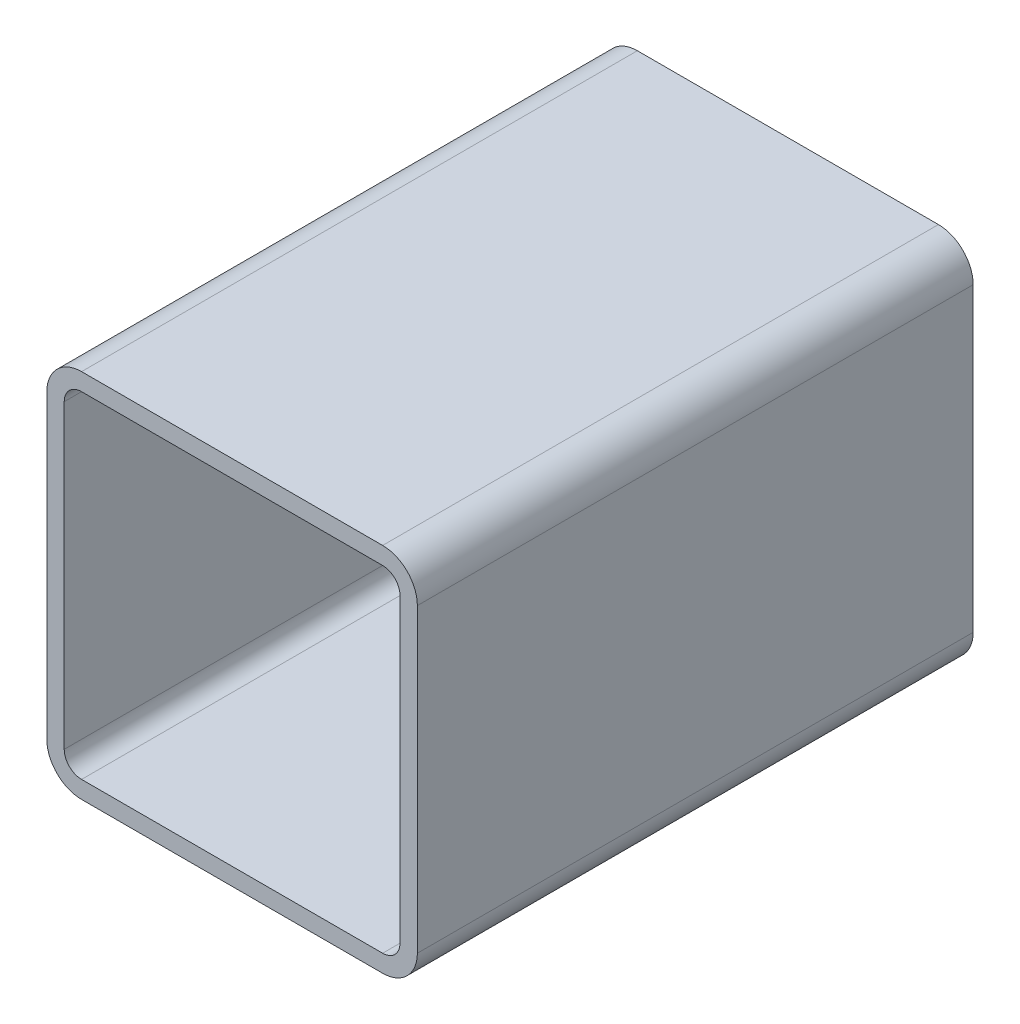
SolidWorks part; units mm, degrees
ref_plane "Front Plane" through (0, 0, 0) normal (0, 0, 1) x (1, 0, 0)
ref_plane "Top Plane" through (0, 0, 0) normal (0, 1, 0) x (1, 0, 0)
ref_plane "Right Plane" through (0, 0, 0) normal (1, 0, 0) x (0, 0, -1)
sketch "Sketch1" plane through (0, 0, 0) normal (0, 0, 1) x (1, 0, 0)
sketch_block_instance "HSS8x8x0.375-1"
sketch_block "HSS8x8x0.375"
extrude "Boss-Extrude1" add sketch "Sketch1" along normal blind 304.8
